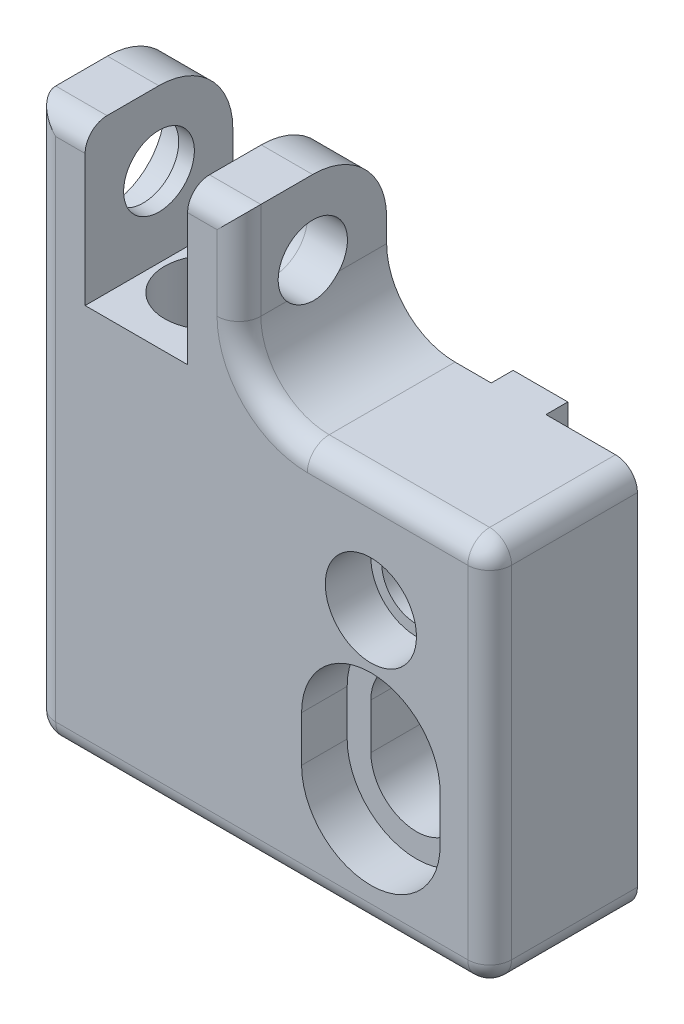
SolidWorks part; units mm, degrees
ref_plane "Спереди" through (0, 0, 0) normal (0, 0, 1) x (1, 0, 0)
ref_plane "Сверху" through (0, 0, 0) normal (0, 1, 0) x (1, 0, 0)
ref_plane "Справа" through (0, 0, 0) normal (1, 0, 0) x (0, 0, -1)
sketch "Эскиз1" plane through (0, 0, 0) normal (0, 0, 1) x (1, 0, 0)
  line L0 (0, -8.5852) -> (0, -11.7602) construction
  line L1 (3.175, -8.5852) -> (3.175, -11.7602)
  line L2 (-3.175, -8.5852) -> (-3.175, -11.7602)
  line L3 (-9.1885, 19.1262) -> (-9.1885, 12.3793)
  line L4 (-4.4259, 7.6168) -> (8.274, 7.6168)
  line L5 (8.274, 7.6168) -> (8.2741, -19.2278)
  line L6 (8.2741, -19.2278) -> (-23.4759, -19.2278)
  line L7 (-23.4759, -19.2278) -> (-23.476, 19.1262)
  line L8 (-23.476, 19.1262) -> (-19.9009, 19.1262)
  line L9 (-19.9009, 19.1262) -> (-19.9009, 8.4328)
  line L10 (-19.9009, 8.4328) -> (-12.7635, 8.4328)
  line L11 (-12.7635, 8.4328) -> (-12.7635, 19.1262)
  line L12 (-12.7635, 19.1262) -> (-9.1885, 19.1262)
  line L13 (-16.3322, 24.3183) -> (-16.3322, -31.0788) construction
  line L14 (-52.6954, 13.97) -> (-22.7986, 13.97) construction
  circle A0 centre (0, 0) radius 2.413
  arc A1 (3.175, -8.5852) -> (-3.175, -8.5852) centre (0, -8.5852) ccw
  arc A2 (-3.175, -11.7602) -> (3.175, -11.7602) centre (0, -11.7602) ccw
  arc A3 (-9.1885, 12.3793) -> (-4.4259, 7.6168) centre (-4.4259, 12.3793) ccw
  point P5 (0, -10.1727)
  dimension "D1" = 4.826
  dimension "D14" = 4.7625
  dimension "D2" = 6.35
  dimension "D3" = 11.5094
  dimension "D4" = 19.1262
  dimension "D5" = 27.7114
  dimension "D6" = 3.175
  dimension "D7" = 5.1562
  dimension "D8" = 31.75
  dimension "D9" = 14.2875
  dimension "D10" = 7.1374
  dimension "D11" = 33.1978
  dimension "D12" = 5.5372
  dimension "D13" = 16.3322
extrude "Бобышка-Вытянуть1" add sketch "Эскиз1" along normal mid plane 10.287
sketch "Эскиз2" plane through (0, 0, -5.1435) normal (0, 0, -1) x (-1, 0, 0)
  line L0 (-8.274, 7.6168) -> (4.4259, 7.6168) construction
  line L1 (1.905, 7.6168) -> (-1.905, 7.6168)
  line L2 (1.905, 7.6168) -> (1.905, 1.4811)
  line L3 (1.905, -19.2278) -> (-1.905, -19.2278)
  line L4 (-1.905, 7.6168) -> (-1.905, 1.4811)
  line L5 (23.4759, -19.2278) -> (-8.2741, -19.2278) construction
  line L6 (0, 7.6168) -> (0, -19.2278) construction
  line L7 (-1.905, -1.4811) -> (-1.905, -6.0452)
  line L8 (1.905, -1.4811) -> (1.905, -6.0452)
  line L9 (1.905, -14.3002) -> (1.905, -19.2278)
  line L10 (-1.905, -14.3002) -> (-1.905, -19.2278)
  arc A0 (-1.905, -1.4811) -> (1.905, -1.4811) centre (0, 0) ccw
  arc A1 (-1.905, -6.0452) -> (1.905, -6.0452) centre (0, -8.5852) cw
  arc A2 (3.175, -8.5852) -> (-3.175, -8.5852) centre (0, -8.5852) ccw construction
  arc A3 (-1.905, -14.3002) -> (1.905, -14.3002) centre (0, -11.7602) ccw
  arc A4 (-3.175, -11.7602) -> (3.175, -11.7602) centre (0, -11.7602) ccw construction
  circle A5 centre (0, 0) radius 2.413 construction
  arc A6 (1.905, 1.4811) -> (-1.905, 1.4811) centre (0, 0) ccw
  dimension "D1" = 3.81
extrude "Бобышка-Вытянуть2" add sketch "Эскиз2" along normal blind 1.524
sketch "Эскиз4" plane through (0, 0, 0) normal (0, 0, 1) x (1, 0, 0)
  line L0 (-16.3322, 21.8203) -> (-16.3322, -25.1234) construction
  line L1 (-16.3322, -19.2278) -> (-14.7447, -19.2278)
  line L2 (-14.7447, -19.2278) -> (-14.7447, -13.7047)
  line L3 (-14.7447, -13.7047) -> (-13.1572, -12.7508)
  line L4 (-13.1572, -12.7508) -> (-13.1572, 19.1262)
  line L5 (-13.1572, 19.1262) -> (-16.3322, 19.1262)
  line L6 (-16.3322, 19.1262) -> (-16.3322, -19.2278)
  line L7 (-9.1885, 19.1262) -> (-12.7635, 19.1262) construction
  line L8 (-23.4759, -19.2278) -> (8.2741, -19.2278) construction
  dimension "D1" = 6.35
  dimension "D2" = 3.175
  dimension "D3" = 59
  dimension "D4" = 6.477
  dimension "D5" = 16.3322
revolve "Вырез-Повернуть1" cut sketch "Эскиз4" angle 360 about L0
sketch "Эскиз5" plane through (0, 0, 5.1435) normal (0, 0, 1) x (1, 0, 0)
  line L0 (0, -8.5852) -> (0, -11.7602) construction
  line L1 (4.826, -8.5852) -> (4.826, -11.7602)
  line L2 (-4.826, -8.5852) -> (-4.826, -11.7602)
  arc A0 (4.826, -8.5852) -> (-4.826, -8.5852) centre (0, -8.5852) ccw
  arc A1 (-4.826, -11.7602) -> (4.826, -11.7602) centre (0, -11.7602) ccw
  arc A2 (3.175, -8.5852) -> (-3.175, -8.5852) centre (0, -8.5852) ccw construction
  arc A3 (-3.175, -11.7602) -> (3.175, -11.7602) centre (0, -11.7602) ccw construction
  circle A4 centre (0, 0) radius 3.175
  point P3 (0, -10.1727)
  dimension "D2" = 6.35
  dimension "D1" = 9.652
extrude "Вырез-Вытянуть1" cut sketch "Эскиз5" against normal blind 3.175
sketch "Эскиз7" plane through (0, 0, 0) normal (0, 0, 1) x (1, 0, 0)
  line L0 (-24.7565, 13.97) -> (-6.9433, 13.97) construction
  line L1 (-23.476, 13.97) -> (-23.476, 17.9324)
  line L2 (-23.476, 17.9324) -> (-20.9868, 17.9324)
  line L3 (-20.9868, 17.9324) -> (-20.9868, 16.4338)
  line L4 (-20.9868, 16.4338) -> (-11.9698, 16.4338)
  line L5 (-11.9698, 16.4338) -> (-11.9698, 16.383)
  line L6 (-11.9698, 16.383) -> (8.2741, 16.383)
  line L7 (8.2741, 16.383) -> (8.2741, 13.97)
  line L8 (8.2741, 13.97) -> (-23.476, 13.97)
  line L9 (-23.476, 19.1262) -> (-23.4759, -19.2278) construction
  line L11 (-9.1885, 19.1262) -> (-12.7635, 19.1262) construction
  line L12 (8.2741, -19.2278) -> (8.274, 7.6168) construction
  dimension "D1" = 4.826
  dimension "D2" = 4.9276
  dimension "D3" = 7.9248
  dimension "D4" = 2.4892
  dimension "D5" = 9.017
  dimension "D6" = 5.1562
revolve "Вырез-Повернуть2" cut sketch "Эскиз7" angle 360 about L0
fillet "Скругление1" radius 5.1562 2 edges at (-10.976, 19.1262, -5.1435) (-21.6884, 19.1262, -5.1435)
fillet "Скругление2" radius 1.524 11 edges at (-9.1885, 15.7528, 5.1435) (-7.7935, 9.0117, 5.1435) (8.2741, -19.2278, 0) (8.274, 7.6168, 0) (-23.4759, -19.2278, 0) (-7.6009, -19.2278, 5.1435) (8.2741, -5.8055, 5.1435) (-23.476, -0.0508, 5.1435) (1.9241, 7.6168, 5.1435) (-21.6884, 19.1262, 5.1435) (-10.976, 19.1262, 5.1435)
